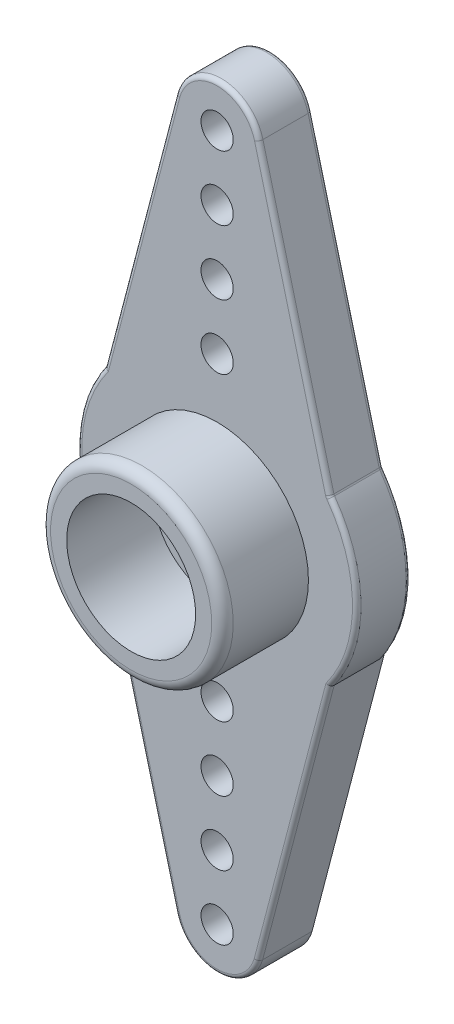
SolidWorks part; units mm, degrees
ref_plane "Front Plane" through (0, 0, 0) normal (0, 0, 1) x (1, 0, 0)
ref_plane "Top Plane" through (0, 0, 0) normal (0, 1, 0) x (1, 0, 0)
ref_plane "Right Plane" through (0, 0, 0) normal (1, 0, 0) x (0, 0, -1)
sketch "Sketch1" plane through (0, 0, 0) normal (0, 0, 1) x (1, 0, 0)
  line L0 (0, 18) -> (0, -18) construction
  line L4 (-6.25, 0) -> (6.25, 0) construction
  line L5 (1.935, 16.5058) -> (5.2471, 3.8365)
  line L6 (-1.935, 16.5058) -> (-5.2471, 3.8365)
  line L9 (1.9193, -16.5625) -> (5.2467, -3.8369)
  line L10 (-1.9193, -16.5625) -> (-5.2467, -3.8369)
  arc A0 (1.935, 16.5058) -> (-1.935, 16.5058) centre (0, 16) ccw
  arc A2 (-1.9193, -16.5625) -> (1.9193, -16.5625) centre (0, -16) ccw
  arc A3 (5.2467, -3.8369) -> (5.2471, 3.8365) centre (0, 0) ccw
  arc A4 (-5.2471, 3.8365) -> (-5.2467, -3.8369) centre (0, 0) ccw
  circle A18 centre (0, 7) radius 0.75
  circle A19 centre (0, 10) radius 0.75
  circle A20 centre (0, 13) radius 0.75
  circle A21 centre (0, 16) radius 0.75
  circle A22 centre (0, 0) radius 1.5
  circle A27 centre (0, -16) radius 0.75
  circle A28 centre (0, -13) radius 0.75
  circle A29 centre (0, -10) radius 0.75
  circle A30 centre (0, -7) radius 0.75
  arc A35 (16.5625, -1.9193) -> (16.5625, 1.9193) centre (16, 0) ccw
  circle A36 centre (16, 0) radius 0.75
  circle A37 centre (13, 0) radius 0.75
  circle A38 centre (10, 0) radius 0.75
  arc A39 (-16.5625, 1.9193) -> (-16.5625, -1.9193) centre (-16, 0) ccw
  circle A40 centre (-16, 0) radius 0.75
  circle A41 centre (-13, 0) radius 0.75
  circle A42 centre (-10, 0) radius 0.75
  circle A43 centre (-7, 0) radius 0.75
  circle A46 centre (7, 0) radius 0.75
  point P18 (0, 0)
  point P38 (0, 0)
  point P47 (0, 0)
  point P89 (0, 0)
  dimension "D2" = 12.5
  dimension "D4" = 13
  dimension "D9" = 7
  dimension "D10" = 1.5
  dimension "D11" = 10
  dimension "D12" = 13
  dimension "D13" = 16
  dimension "D14" = 3
  dimension "D3" = 4
  dimension "D15" = 4
extrude "Boss-Extrude1" add sketch "Sketch1" along normal blind 2.5
sketch "Sketch2" plane through (0, 0, 2.5) normal (0, 0, 1) x (1, 0, 0)
  circle A0 centre (0, 0) radius 4.25
  circle A1 centre (0, 0) radius 3
  dimension "D1" = 8.5
  dimension "D2" = 6
extrude "Boss-Extrude2" add sketch "Sketch2" along normal blind 4
sketch "Sketch3" plane through (0, 0, 0) normal (0, 0, -1) x (-1, 0, 0)
  circle A0 centre (0, 0) radius 4.5
  dimension "D1" = 9
extrude "Cut-Extrude1" cut sketch "Sketch3" against normal blind 0.8
sketch "Sketch4" plane through (0, 0, 0.8) normal (0, 0, -1) x (-1, 0, 0)
  circle A0 centre (0, 0) radius 3.5
  circle A1 centre (0, 0) radius 3.7
  dimension "D1" = 7
  dimension "D2" = 0.2
extrude "Boss-Extrude3" add sketch "Sketch4" along normal blind 1
fillet "Fillet2" radius 0.5 1 edges at (4.25, 0, 6.5)
fillet "Fillet3" radius 0.2 13 edges at (3.583, -10.1997, 2.5) (0, -18, 2.5) (-3.583, -10.1997, 2.5) (-3.591, 10.1712, 2.5) (0, 18, 2.5) (-3.591, 10.1712, 0) (0, 18, 0) (3.591, 10.1712, 2.5) (3.591, 10.1712, 0) (6.5, -0.0003, 2.5) (6.5, -0.0003, 0) (5.2471, 3.8365, 1.25) (-6.5, -0.0003, 2.5)
